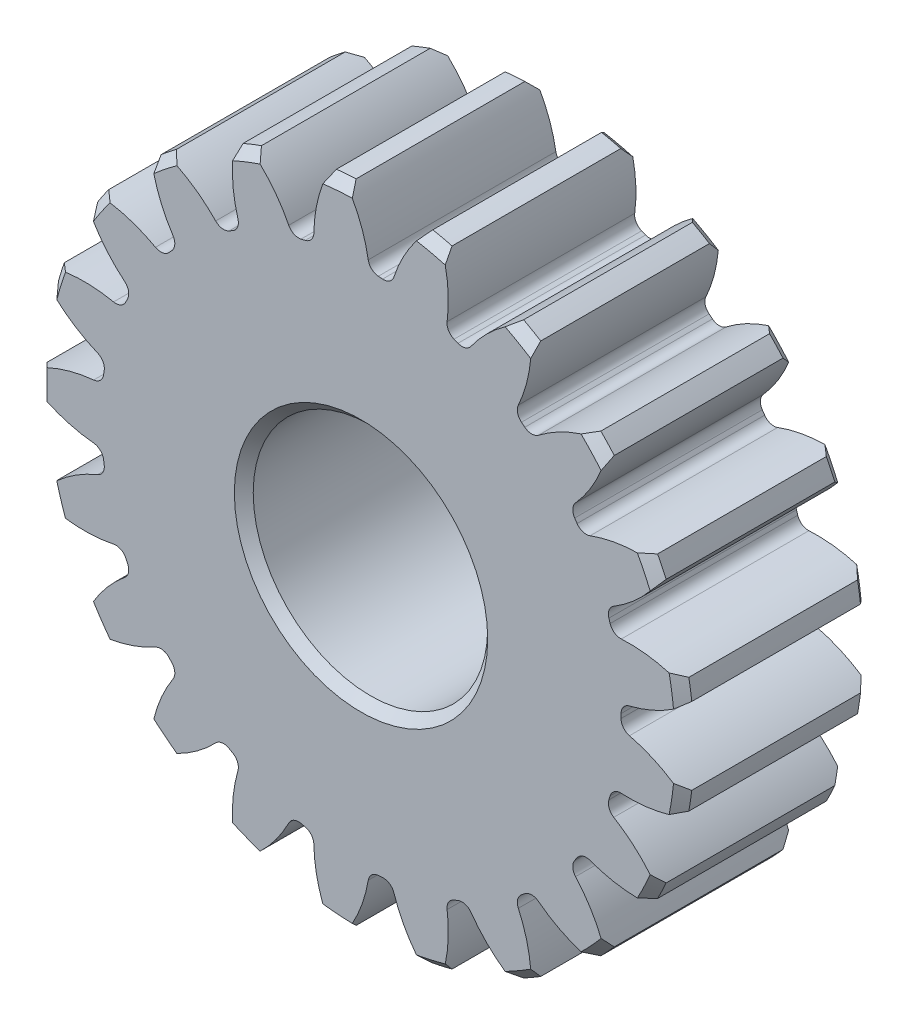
SolidWorks part; units mm, degrees
ref_plane "Front Plane" through (0, 0, 0) normal (0, 0, 1) x (1, 0, 0)
ref_plane "Top Plane" through (0, 0, 0) normal (0, 1, 0) x (1, 0, 0)
ref_plane "Right Plane" through (0, 0, 0) normal (1, 0, 0) x (0, 0, -1)
sketch "Sketch1" plane through (0, 0, 0) normal (0, 0, 1) x (1, 0, 0)
  line L0 (0, 0) -> (0, 3.15) construction
  line L1 (-1.0124, 3.5185) -> (1.0124, 2.7815) construction
  circle A0 centre (0, 0) radius 2.775 construction
  circle A1 centre (0, 0) radius 3.45 construction
  circle A2 centre (0, 0) radius 3.15 construction
  circle A3 centre (0, 0) radius 2.96 construction
  circle A5 centre (0, 0) radius 1.25 construction
  point P8 (0.15, 0)
  point P13 (10.5, 0)
sketch "Sketch2" plane through (0, 0, 0) normal (1, 0, 0) x (0, 0, -1)
  line L0 (-1, 0) -> (1, 0) construction
  line L1 (1, 3.45) -> (1, -3.45) construction
  line L3 (-1, 3.45) -> (1, 3.45) construction
  line L5 (-1, 12.5) -> (-1, -12.5) construction
  point P2 (0, 3.45)
  dimension "Overall Width" = 2
  dimension "Face Width" = 1
sketch "Sketch3" plane through (0, 0, 0) normal (0, 0, 1) x (1, 0, 0)
  circle A0 centre (0, 0) radius 3.45
  circle A1 centre (0, 0) radius 3.45 construction
extrude "Boss-Extrude1" add sketch "Sketch3" against normal up to vertex (1 mm away) and the other way up to vertex (1 mm away)
sketch "Sketch5" plane through (0, 0, 0) normal (1, 0, 0) x (0, 0, -1)
  line L5 (-1, 0) -> (1, 0)
  line L6 (-1, 0) -> (-1, 1.25)
  line L7 (-1, 1.25) -> (1, 1.25)
  line L8 (1, 0) -> (1, 1.25)
  point P12 (0, 1.25)
revolve "Cut-Revolve1" cut sketch "Sketch5" angle 360 about L0
chamfer "Chamfer2" distance 0.1007 angle 45 4 edges at (3.45, 0, -1) (1.25, 0, -1) (1.25, 0, 1) (3.45, 0, 1)
sketch "Sketch4" plane through (0, 0, 0) normal (0, 0, 1) x (1, 0, 0)
  line L0 (2.7725, -0.1178) -> (2.7725, 0.1178)
  arc A3 (3.4255, 0.41) -> (3.4255, -0.41) centre (0, 0) cw
  circle A4 centre (0, 0) radius 3.45 construction
  arc A5 (3.4255, 0.41) -> (2.7725, 0.1178) centre (2.4963, 1.6108) cw
  circle A6 centre (0, 0) radius 2.775 construction
  arc A7 (3.4255, -0.41) -> (2.7725, -0.1178) centre (2.4963, -1.6108) ccw
  spline S0 degree 4 poles (2.9547, 0.1772) (2.9555, 0.1772) (2.9577, 0.1774) (2.9618, 0.1779) (2.9686, 0.1789) (2.9771, 0.1803) (2.9881, 0.1825) (3.0011, 0.1855) (3.0152, 0.1891) (3.0306, 0.1935) (3.0458, 0.1982) (3.061, 0.2033) (3.076, 0.2086) (3.0942, 0.2155) (3.1158, 0.2242) (3.141, 0.2351) (3.1693, 0.2484) (3.198, 0.2628) (3.226, 0.2777) (3.254, 0.2937) (3.281, 0.3097) (3.3088, 0.3273) (3.3343, 0.3439) (3.3626, 0.3635) (3.3853, 0.3796) (3.415, 0.4018) (3.4324, 0.4153) (3.4526, 0.4313) (3.4616, 0.4387) (3.4671, 0.4432) knots 0 0 0 0 0 0.005377 0.015084 0.028532 0.04661 0.064855 0.092111 0.119476 0.146842 0.174209 0.201575 0.228941 0.256307 0.307035 0.361767 0.4165 0.471232 0.525964 0.580697 0.635429 0.690161 0.744894 0.799626 0.854358 0.909091 0.954545 1 1 1 1 1 construction
  spline S1 degree 4 poles (2.9547, 0.1772) (2.9555, 0.1772) (2.9577, 0.1774) (2.9618, 0.1779) (2.9686, 0.1789) (2.9771, 0.1803) (2.9881, 0.1825) (3.0011, 0.1855) (3.0152, 0.1891) (3.0306, 0.1935) (3.0458, 0.1982) (3.061, 0.2033) (3.076, 0.2086) (3.0942, 0.2155) (3.1158, 0.2242) (3.141, 0.2351) (3.1693, 0.2484) (3.198, 0.2628) (3.226, 0.2777) (3.254, 0.2937) (3.281, 0.3097) (3.3088, 0.3273) (3.3343, 0.3439) (3.3626, 0.3635) (3.3853, 0.3796) (3.4085, 0.397) (3.4198, 0.4056) (3.4255, 0.41) knots 0 0 0 0 0 0.005377 0.015084 0.028532 0.04661 0.064855 0.092111 0.119476 0.146842 0.174209 0.201575 0.228941 0.256307 0.307035 0.361767 0.4165 0.471232 0.525964 0.580697 0.635429 0.690161 0.744894 0.799626 0.854358 0.909091 0.909091 0.909091 0.909091 0.909091 construction
  spline S2 degree 4 poles (2.9547, -0.1772) (2.9555, -0.1772) (2.9577, -0.1774) (2.9618, -0.1779) (2.9686, -0.1789) (2.9771, -0.1803) (2.9881, -0.1825) (3.0011, -0.1855) (3.0152, -0.1891) (3.0306, -0.1935) (3.0458, -0.1982) (3.061, -0.2033) (3.076, -0.2086) (3.0942, -0.2155) (3.1158, -0.2242) (3.141, -0.2351) (3.1693, -0.2484) (3.198, -0.2628) (3.226, -0.2777) (3.254, -0.2937) (3.281, -0.3097) (3.3088, -0.3273) (3.3343, -0.3439) (3.3626, -0.3635) (3.3853, -0.3796) (3.415, -0.4018) (3.4324, -0.4153) (3.4526, -0.4313) (3.4616, -0.4387) (3.4671, -0.4432) knots 0 0 0 0 0 0.005377 0.015084 0.028532 0.04661 0.064855 0.092111 0.119476 0.146842 0.174209 0.201575 0.228941 0.256307 0.307035 0.361767 0.4165 0.471232 0.525964 0.580697 0.635429 0.690161 0.744894 0.799626 0.854358 0.909091 0.954545 1 1 1 1 1 construction
  spline S3 degree 4 poles (2.9547, -0.1772) (2.9555, -0.1772) (2.9577, -0.1774) (2.9618, -0.1779) (2.9686, -0.1789) (2.9771, -0.1803) (2.9881, -0.1825) (3.0011, -0.1855) (3.0152, -0.1891) (3.0306, -0.1935) (3.0458, -0.1982) (3.061, -0.2033) (3.076, -0.2086) (3.0942, -0.2155) (3.1158, -0.2242) (3.141, -0.2351) (3.1693, -0.2484) (3.198, -0.2628) (3.226, -0.2777) (3.254, -0.2937) (3.281, -0.3097) (3.3088, -0.3273) (3.3343, -0.3439) (3.3626, -0.3635) (3.3853, -0.3796) (3.4085, -0.397) (3.4198, -0.4056) (3.4255, -0.41) knots 0 0 0 0 0 0.005377 0.015084 0.028532 0.04661 0.064855 0.092111 0.119476 0.146842 0.174209 0.201575 0.228941 0.256307 0.307035 0.361767 0.4165 0.471232 0.525964 0.580697 0.635429 0.690161 0.744894 0.799626 0.854358 0.909091 0.909091 0.909091 0.909091 0.909091 construction
extrude "Cut-Extrude1" cut sketch "Sketch4" against normal through all both and the other way through all
fillet "Fillet1" radius 0.1178 2 edges at (2.7725, -0.1178, 0) (2.7725, 0.1178, 0)
pattern_circular "CirPattern1" count 21 over 360 about axis through (0, 0, 0) along (0, 0, 1) of "Cut-Extrude1", "Fillet1"
equation "\"Number of Teeth\"= 21"
equation "\"Module\"= 0.3"
equation "\"Diametral Pitch\"= 1 / \"Module\""
equation "\"Dedendum\"= 1.25 / \"Diametral Pitch\""
equation "\"Pitch Diameter\"= \"Module\" * \"Number of Teeth\""
equation "\"Root Diameter\"= \"Pitch Diameter\" - ( 2 * \"Dedendum\" )"
equation "\"Root Diameter@Sketch1\"=\"Root Diameter\""
equation "\"OD@Sketch1\" = \"Outside Diameter\""
equation "\"D1@CirPattern1\"=\"Number of Teeth\""
equation "\"Pressure Angle\"= 20"
equation "\"Base Diameter\"= \"Pitch Diameter\" * cos ( \"Pressure Angle\" )"
equation "\"Outside Diameter\"= ( \"Number of Teeth\" + 2 ) / \"Diametral Pitch\""
equation "\"Pitch Angle\"= 360deg / \"Number of Teeth\""
equation "\"Alpha\"= sqr ( \"Pitch Diameter\" ^ 2 - \"Base Diameter\" ^ 2 ) / \"Base Diameter\" * 180 / PI - \"Pressure Angle\""
equation "\"Beta\"= ( \"Pitch Angle\" / 4 - \"Alpha\" )"
equation "\"Phi\"= sqr ( ( \"Outside Diameter\" / 2 ) ^ 2 - ( \"Base Diameter\" / 2 ) ^ 2 ) / ( \"Base Diameter\" / 2 )"
equation "\"Addendum\"= 1 / \"Diametral Pitch\""
equation "\"WorkingDepth\"= 2 / \"Diametral Pitch\""
equation "\"WholeDepth\"= 2.25 / \"Diametral Pitch\""
equation "\"Clearance\"= 0.25 / \"Diametral Pitch\""
equation "\"ToothThickness\"= ( pi * 2 ) / \"Diametral Pitch\""
equation "\"CircularPitch\"= pi / \"Diametral Pitch\""
equation "\"Number of Teeth@Sketch1\"=\"Number of Teeth\""
equation "\"Module@Sketch1\"=\"Module\""
equation "\"Pressure Angle@Sketch1\"=\"Pressure Angle\""
equation "\"Gear Pitch Diameter@Sketch1\"=\"Pitch Diameter\""
equation "\"Base Diameter@Sketch1\"=\"Base Diameter\""
equation "\"Fillet\"= \"Clearance\" * cos ( \"Pressure Angle\" ) * tan ( ( 90 + \"Pressure Angle\" ) / 2 )"
equation "\"D1\"= \"Fillet\""
equation "\"D1\"= \"Set Screw Pitch@Sketch1\" * .75"
equation "\"D1\"= \"Set Screw Diameter@Sketch1\" / 2"
equation "\"D3\"= \"Set Screw Pitch@Sketch1\" +  ( \"Hub Diameter@Sketch1\" / 2 ) "
equation "\"D4\"= \"Set Screw Pitch@Sketch1\""
equation "\"D2\"= \"Fillet\" * 2"
equation "\"D1\"= \"Fillet\" * 2"
equation "\"D1@Chamfer2\"=\"Fillet\""
equation "\"D1@Sketch4\"=\"CircularPitch\"*0.25"
equation "\"D1@Fillet1\"=\"CircularPitch\"*0.125"
